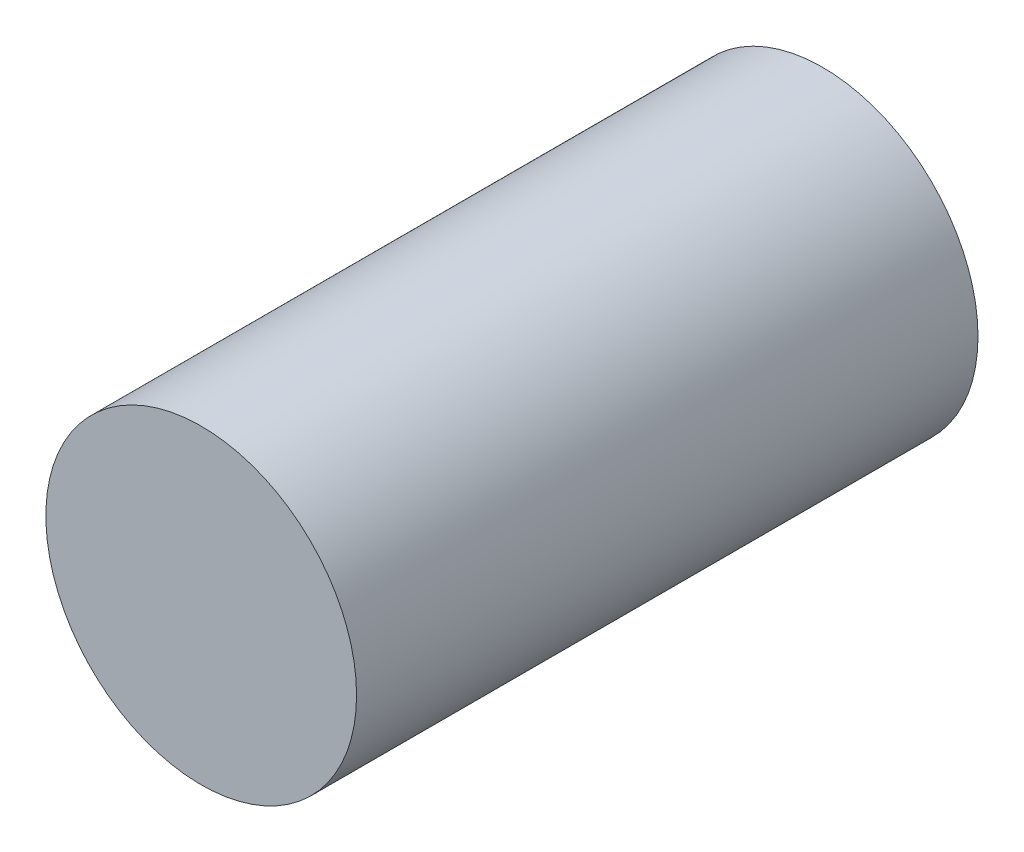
SolidWorks part; units mm, degrees
ref_plane "Front" through (0, 0, 0) normal (0, 0, 1) x (1, 0, 0)
ref_plane "Top" through (0, 0, 0) normal (0, 1, 0) x (1, 0, 0)
ref_plane "Right" through (0, 0, 0) normal (1, 0, 0) x (0, 0, -1)
sketch "Sketch1" plane through (0, 0, 0) normal (0, 0, 1) x (1, 0, 0)
  circle A0 centre (0, 0) radius 25.4
  dimension "D1" = 50.8
extrude "Extrude1" add sketch "Sketch1" along normal blind 101.6
